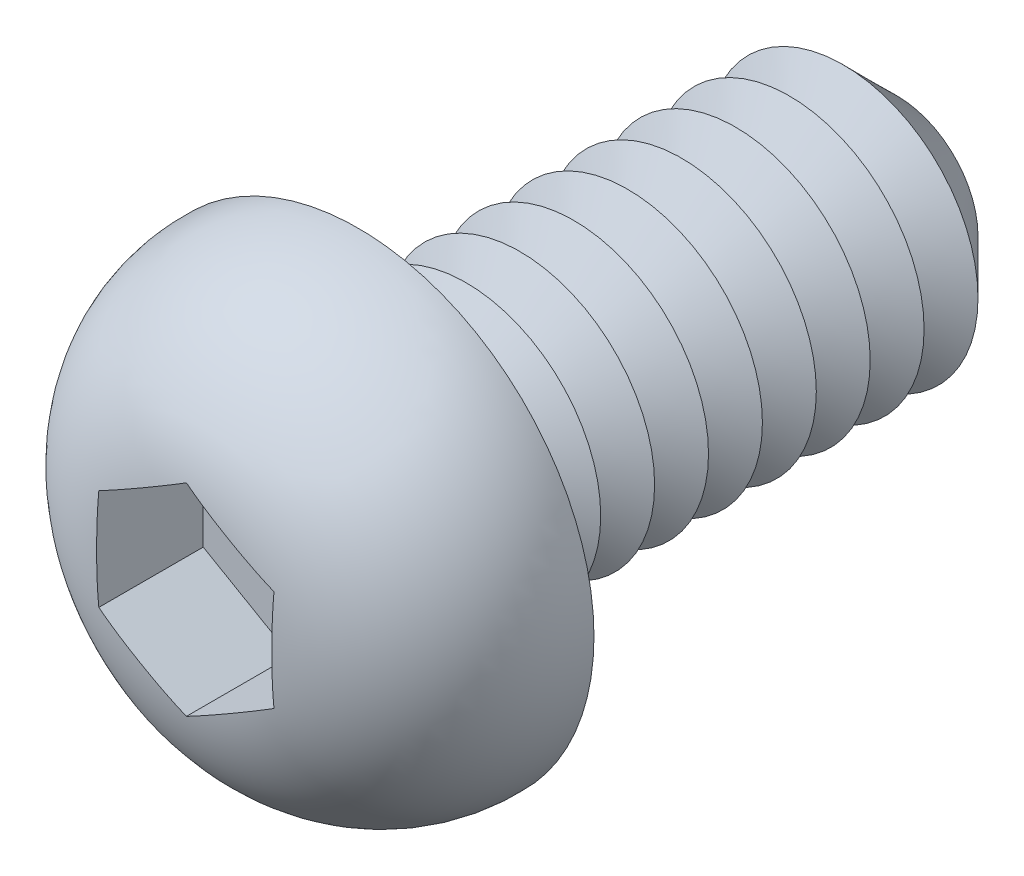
SolidWorks part; units mm, degrees
ref_plane "Front Plane" through (0, 0, 0) normal (0, 0, 1) x (1, 0, 0)
ref_plane "Top Plane" through (0, 0, 0) normal (0, 1, 0) x (1, 0, 0)
ref_plane "Right Plane" through (0, 0, 0) normal (1, 0, 0) x (0, 0, -1)
sketch "Sketch1" plane through (0, 0, 0) normal (1, 0, 0) x (0, 0, -1)
  line L0 (-47.9342, 0) -> (60.3146, 0) construction
sketch "Sketch2" plane through (0, 0, 0) normal (1, 0, 0) x (0, 0, -1)
  line L0 (0, 0) -> (-1.3, 0)
  line L1 (-47.9342, 0) -> (60.3146, 0) construction
  line L2 (-1.3, 0) -> (-1.3, 0.501)
  line L3 (0, 1.75) -> (0, 0)
  arc A0 (-1.3, 0.501) -> (0, 1.75) centre (-0.05, 0.501) cw
  dimension "D1" = 1.25
  dimension "D2" = 1.3
  dimension "D3" = 1.75
revolve "Revolve1" add sketch "Sketch2" angle 360 about L0
sketch "Sketch3" plane through (0, 0, 1.3) normal (0, 0, 1) x (1, 0, 0)
  line L1 (0, 0.7506) -> (-0.65, 0.3753)
  line L2 (-0.65, 0.3753) -> (-0.65, -0.3753)
  line L3 (-0.65, -0.3753) -> (0, -0.7506)
  line L4 (0, -0.7506) -> (0.65, -0.3753)
  line L5 (0.65, -0.3753) -> (0.65, 0.3753)
  line L6 (0.65, 0.3753) -> (0, 0.7506)
  circle A0 centre (0, 0) radius 0.65 construction
  dimension "D1" = 1.3
extrude "Cut-Extrude1" cut sketch "Sketch3" against normal blind 0.8
sketch "Sketch4" plane through (0, 0, 0) normal (0, 0, -1) x (-1, 0, 0)
  circle A0 centre (0, 0) radius 1
  dimension "D1" = 2
extrude "Boss-Extrude1" add sketch "Sketch4" along normal blind 4
chamfer "Chamfer1" distance 0.4 angle 45 1 edges at (-1, 0, -4)
sketch "Sketch5" plane through (0, 0, 0) normal (1, 0, 0) x (0, 0, -1)
  line L0 (0.4, 1) -> (0.8, 1)
  line L1 (3.6, 1) -> (0, 1) construction
  line L2 (0.8, 1) -> (0.6, 0.6536)
  line L3 (0.6, 0.6536) -> (0.4, 1)
  line L4 (0, -1.75) -> (0, 1.75) construction
  line L5 (3.6, 1) -> (0, 1) construction
  dimension "D1" = 0.4
  dimension "D2" = 0.4
revolve "Cut-Revolve1" cut sketch "Sketch5" angle 360 about L0
pattern_linear "LPattern1" count 8 spacing 0.4 along (0, 0, -1) of "Cut-Revolve1"
fillet "Fillet2" radius 0.2 1 edges at (-1, 0, 0)
sketch "Sketch6" plane through (0, 0, 0.5) normal (0, 0, 1) x (1, 0, 0)
  circle A0 centre (0, 0) radius 0.35
  dimension "D1" = 0.7
extrude "Cut-Extrude2" cut sketch "Sketch6" against normal up to surface (4.5 mm away)
